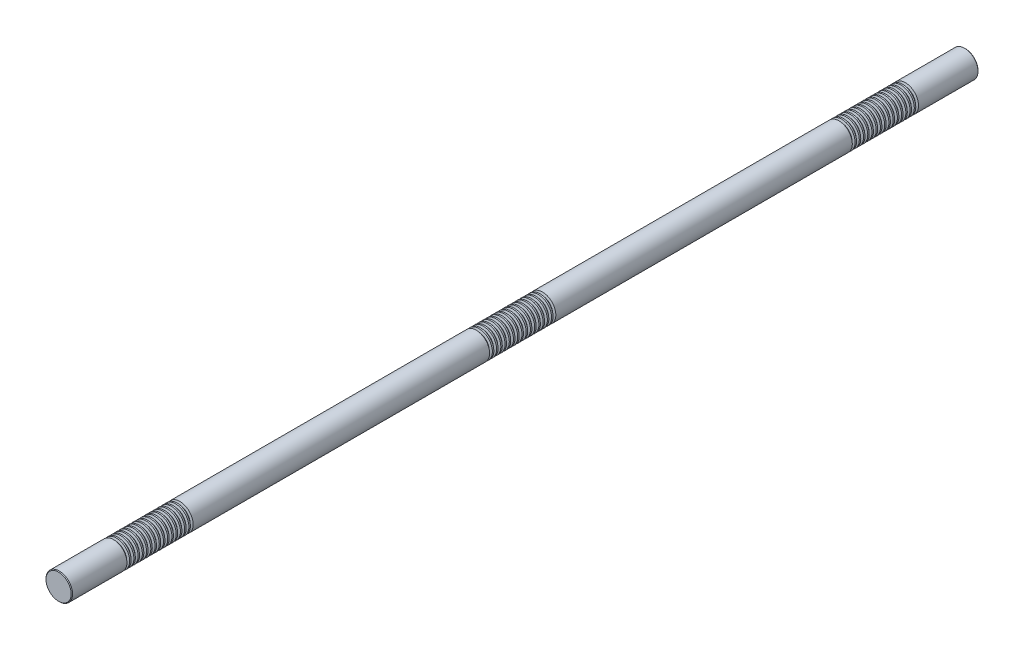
SolidWorks part; units mm, degrees
ref_plane "Front Plane" through (0, 0, 0) normal (0, 0, 1) x (1, 0, 0)
ref_plane "Top Plane" through (0, 0, 0) normal (0, 1, 0) x (1, 0, 0)
ref_plane "Right Plane" through (0, 0, 0) normal (1, 0, 0) x (0, 0, -1)
sketch "Sketch1" plane through (0, 0, 0) normal (0, 0, 1) x (1, 0, 0)
  circle A0 centre (0, 0) radius 22
  dimension "D1" = 44
extrude "Boss-Extrude1" add sketch "Sketch1" along normal mid plane 1500
chamfer "Chamfer1" distance 1.1 angle 45 2 edges at (22, 0, -750) (22, 0, 750)
sketch "Sketch2" plane through (0, 0, 0) normal (1, 0, 0) x (0, 0, -1)
  line L0 (650.5359, 22) -> (645.9641, 22)
  line L1 (748.9, 22) -> (-748.9, 22) construction
  line L2 (645.9641, 22) -> (647.0359, 18)
  line L3 (647.0359, 18) -> (649.4641, 18)
  line L4 (649.4641, 18) -> (650.5359, 22)
  line L5 (750, -20.9) -> (750, 20.9) construction
  point P4 (648.25, 22)
  point P7 (648.25, 18)
  point P8 (650, 20)
  point P9 (646.5, 20)
  dimension "D1" = 3.5
  dimension "D2" = 100
  dimension "D3" = 4
  dimension "D4" = 30
revolve "Cut-Revolve1" cut sketch "Sketch2" angle 360 about axis through (0, 0, 750) along (0, 0, -1)
pattern_linear "LPattern1" count 16 spacing 7 along (0, 0, 1) of "Cut-Revolve1"
pattern_linear "LPattern2" count 3 spacing 600 along (0, 0, 1) of "Cut-Revolve1", "LPattern1"
